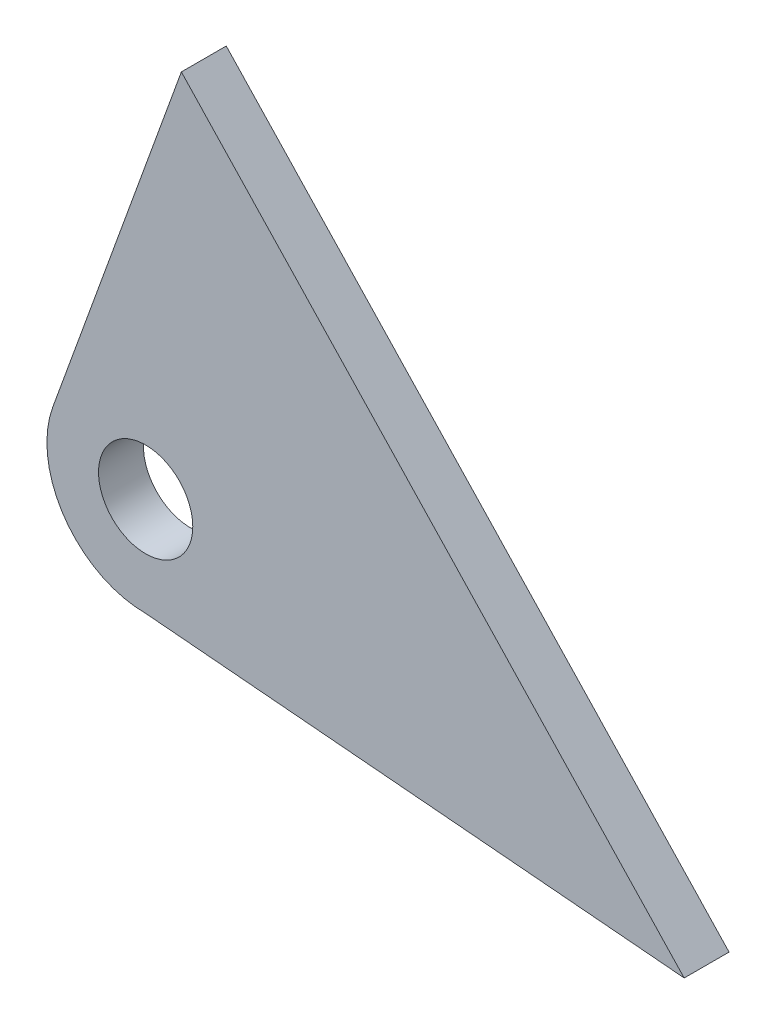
SolidWorks part; units mm, degrees
ref_plane "Plan de face" through (0, 0, 0) normal (0, 0, 1) x (1, 0, 0)
ref_plane "Plan de dessus" through (0, 0, 0) normal (0, 1, 0) x (1, 0, 0)
ref_plane "Plan de droite" through (0, 0, 0) normal (1, 0, 0) x (0, 0, -1)
sketch "Esquisse1" plane through (0, 0, -20) normal (0, 0, 1) x (1, 0, 0)
  line L0 (-25.3409, -6.2497) -> (-11.0215, 33.2339)
  line L1 (-15, -21) -> (45, -26.1797)
  line L2 (-65.6292, 88.4666) -> (99.9187, -83.0927) construction
  line L3 (-11.0215, 33.2339) -> (45, -26.1797)
  line L4 (115, 141.2414) -> (115, -487.7469) construction
  circle A0 centre (-15, -10) radius 5.25
  arc A1 (-25.3409, -6.2497) -> (-15, -21) centre (-15, -10) ccw
  dimension "D1" = 10.5
  dimension "D2" = 22
  dimension "D3" = 70
  dimension "D4" = 42
  dimension "D5" = 75
extrude "Extrusion1" add sketch "Esquisse1" along normal blind 5
